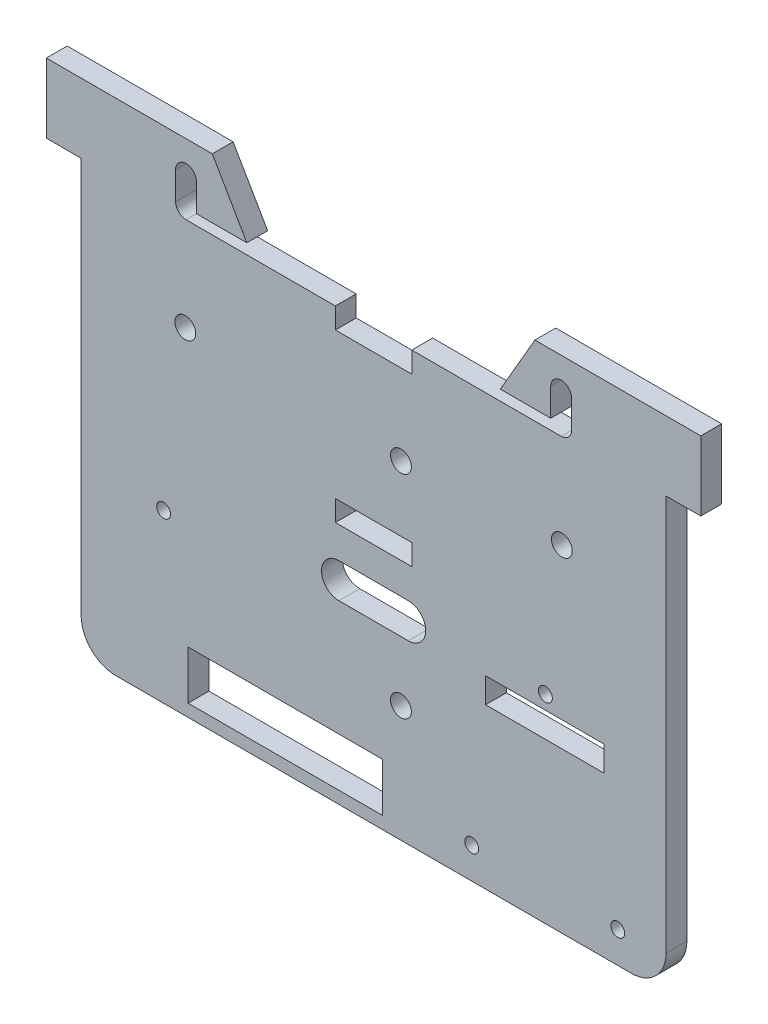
SolidWorks part; units mm, degrees
other "Pièce23^K-Enceint-BT-V2"
ref_plane "Plan de face" through (0, 0, 0) normal (0, 0, 1) x (1, 0, 0)
ref_plane "Plan de dessus" through (0, 0, 0) normal (0, 1, 0) x (1, 0, 0)
ref_plane "Plan de droite" through (0, 0, 0) normal (1, 0, 0) x (0, 0, -1)
imported_body "Importée1"
sketch "Esquisse1" plane through (0, 0, 0) normal (0, 0, -1) x (-1, 0, 0)
  line L0 (-51.0385, -41.7232) -> (-51.0385, -72.2232) construction
  line L2 (-5, -27) -> (-5, -84) construction
  circle A1 centre (-51.0385, -41.7232) radius 1.5
  dimension "D1" = 3
  dimension "D2" = 30.5
  dimension "D3" = 46.0385
extrude "Enlèv. mat.-Extru.1" cut sketch "Esquisse1" against normal through all
